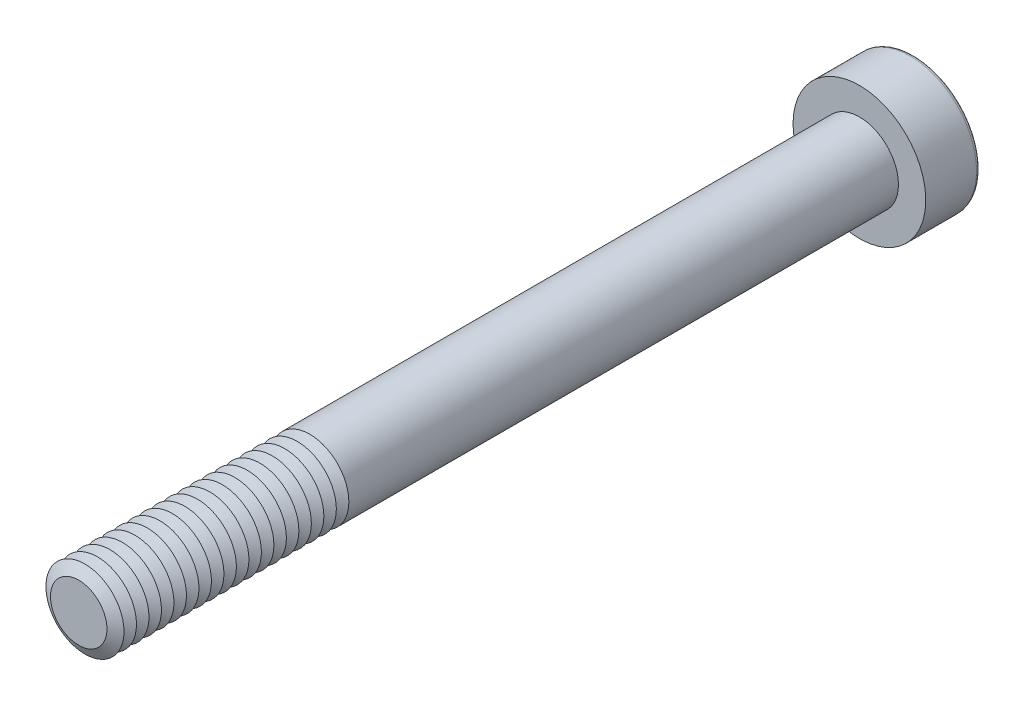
SolidWorks part; units mm, degrees
ref_plane "Front Plane" through (0, 0, 0) normal (0, 0, 1) x (1, 0, 0)
ref_plane "Top Plane" through (0, 0, 0) normal (0, 1, 0) x (1, 0, 0)
ref_plane "Right Plane" through (0, 0, 0) normal (1, 0, 0) x (0, 0, -1)
sketch "Sketch1" plane through (0, 0, 0) normal (0, 0, 1) x (1, 0, 0)
  circle A0 centre (0, 0) radius 2.5
  dimension "D1" = 5
extrude "Boss-Extrude1" add sketch "Sketch1" along normal blind 50
sketch "Sketch2" plane through (0, 0, 0) normal (0, 0, -1) x (-1, 0, 0)
  circle A0 centre (0, 0) radius 4.25
  dimension "D1" = 8.5
extrude "Boss-Extrude2" add sketch "Sketch2" along normal blind 3.5
sketch "Sketch3" plane through (0, 0, -3.5) normal (0, 0, -1) x (-1, 0, 0)
  line L1 (-0.866, 1.5) -> (-1.7321, 0)
  line L2 (-1.7321, 0) -> (-0.866, -1.5)
  line L3 (-0.866, -1.5) -> (0.866, -1.5)
  line L4 (0.866, -1.5) -> (1.7321, 0)
  line L5 (1.7321, 0) -> (0.866, 1.5)
  line L6 (0.866, 1.5) -> (-0.866, 1.5)
  circle A0 centre (0, 0) radius 1.5 construction
  dimension "D1" = 3
extrude "Cut-Extrude1" cut sketch "Sketch3" against normal blind 2.25
fillet "Fillet1" radius 0.25 1 edges at (-4.25, 0, -3.5)
sketch "Sketch4" plane through (0, 0, -1.25) normal (0, 0, -1) x (-1, 0, 0)
  line L0 (0.866, -1.5) -> (1.7321, 0) construction
  circle A0 centre (0, 0) radius 1.5
extrude "Cut-Extrude2" cut sketch "Sketch4" against normal through all draft 60
sketch "Sketch5" plane through (0, 0, -3.5) normal (0, 0, -1) x (-1, 0, 0)
  circle A0 centre (0, 0) radius 1.7321
extrude "Cut-Extrude3" cut sketch "Sketch5" against normal through all draft 75
sketch "Sketch7" plane through (0, 0, 0) normal (1, 0, 0) x (0, 0, -1)
  line L25 (-50, 1.8072) -> (-49.6, 2.5)
  line L26 (-50, 2.5) -> (-50, -2.5) construction
  line L27 (-49.6, 2.5) -> (-50.4, 2.5)
  line L28 (-50.4, 2.5) -> (-50, 1.8072)
  line L29 (0, 2.5) -> (-50, 2.5) construction
  dimension "D1" = 0.8
revolve "Cut-Revolve1" cut sketch "Sketch7" angle 360 about axis through (0, 0, 50) along (0, 0, -1)
pattern_linear "LPattern1" count 19 spacing 0.8 along (0, 0, -1) of "Cut-Revolve1"
